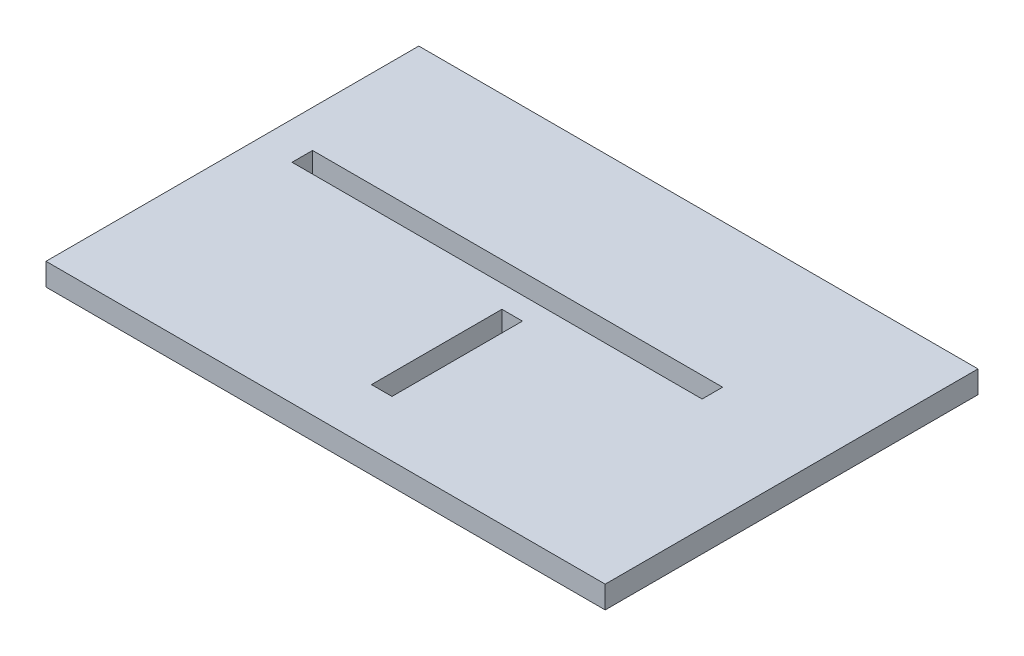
SolidWorks part; units mm, degrees
ref_plane "Front Plane" through (0, 0, 0) normal (0, 0, 1) x (1, 0, 0)
ref_plane "Top Plane" through (0, 0, 0) normal (0, 1, 0) x (1, 0, 0)
ref_plane "Right Plane" through (0, 0, 0) normal (1, 0, 0) x (0, 0, -1)
sketch "Sketch1" plane through (0, 0, 0) normal (0, 1, 0) x (1, 0, 0)
  line L0 (0.05, 0) -> (-49999.95, 0) construction
  line L1 (-75, 50) -> (75, 50)
  line L2 (-75, 50) -> (-75, -50)
  line L3 (-75, -50) -> (75, -50)
  line L4 (75, 50) -> (75, -50)
  line L5 (0, 0) -> (0, 50000) construction
  line L7 (-2.7, 2) -> (-2.7, -35) construction
  line L8 (45, 6) -> (-65, 6) construction
  line L9 (-2.7, 0) -> (2.8, 0)
  line L10 (-2.7, 0) -> (-2.7, -35)
  line L11 (-2.7, -35) -> (2.8, -35)
  line L12 (2.8, 0) -> (2.8, -35)
  line L15 (0, 8.9) -> (0, 6) construction
  line L17 (-65, 11.5) -> (45, 11.5)
  line L18 (-65, 11.5) -> (-65, 6)
  line L19 (-65, 6) -> (45, 6)
  line L20 (45, 11.5) -> (45, 6)
  line L23 (-65, 11.5) -> (-65, 6) construction
  point P0 (0, 0)
  point P8 (0.05, 0)
  point P15 (0, 0)
  point P19 (0, 8.9)
  dimension "D1" = 150
  dimension "D2" = 100
  dimension "D3" = 30
  dimension "D5" = 5.5
  dimension "D6" = 15
  dimension "D7" = 35
  dimension "D8" = 6
  dimension "D9" = 5.5
extrude "Boss-Extrude1" add sketch "Sketch1" along normal blind 6
